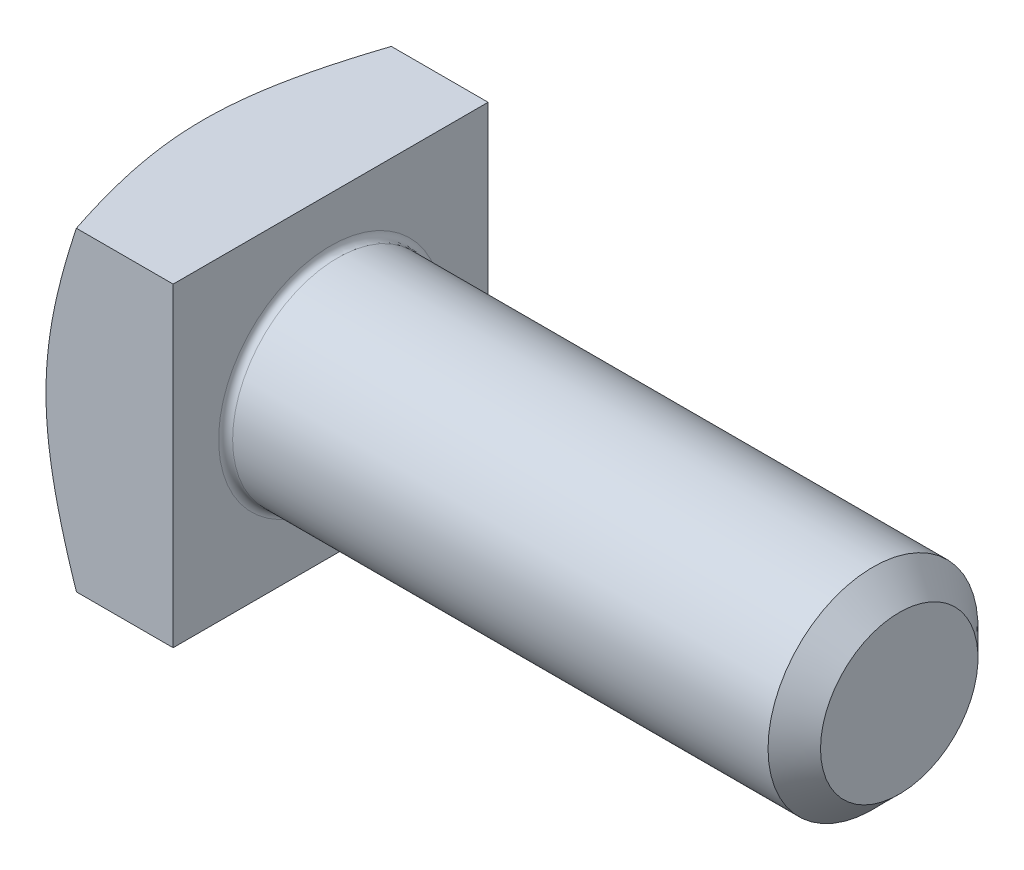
SolidWorks part; units mm, degrees
ref_plane "Front Plane" through (0, 0, 0) normal (0, 0, 1) x (1, 0, 0)
ref_plane "Top Plane" through (0, 0, 0) normal (0, 1, 0) x (1, 0, 0)
ref_plane "Right Plane" through (0, 0, 0) normal (1, 0, 0) x (0, 0, -1)
sketch "BaseHeadSke" plane through (0, 0, 0) normal (1, 0, 0) x (0, 0, -1)
  line L0 (18, 18) -> (-18, -18) construction
  line L2 (18, 18) -> (-18, 18)
  line L3 (-18, 18) -> (-18, -18)
  line L5 (-18, -18) -> (18, -18)
  line L6 (18, -18) -> (18, 18)
  dimension "Width_flats" = 36
extrude "BaseHead" add sketch "BaseHeadSke" along normal blind 15
sketch "BodySke" plane through (0, 0, 0) normal (0, 0, 1) x (1, 0, 0)
  line L0 (0, 0) -> (80, 0)
  line L1 (80, 0) -> (80, 12)
  line L2 (51.3878, 10.352) -> (123.0174, 10.352) construction
  line L3 (80, 12) -> (0, 12)
  line L4 (0, 12) -> (0, 0)
  line L5 (15, 18) -> (15, -18) construction
  line L6 (0, 0) -> (159.3976, 0) construction
  line L7 (26, -84.3176) -> (26, 77.7215) construction
  line L8 (77, -21.5941) -> (77, 39.2994) construction
  dimension "Length" = 65
  dimension "Diameter" = 24
  dimension "Minor_dia" = 20.704
  dimension "Thread_length" = 54
  dimension "Advance" = 3
revolve "BaseBody" add sketch "BodySke" angle 360 about L6
sketch "ChamferEndSke" plane through (0, 0, 0) normal (0, 1, 0) x (1, 0, 0)
  line L0 (77, -12) -> (80, -9)
  line L1 (80, -9) -> (80, -12)
  line L2 (80, -12) -> (77, -12)
  line L4 (80, -12) -> (80, 12) construction
  line L5 (15, -12) -> (80, -12) construction
  line L6 (0, 0) -> (120.8692, 0) construction
  dimension "Ang" = 45
  dimension "Chamfer_width" = 3
revolve "ChamferEnd" cut sketch "ChamferEndSke" angle 360 about L6
sketch "CutEndSke" plane through (80, 0, 0) normal (1, 0, 0) x (0, 0, -1)
  circle A0 centre (0, 0) radius 12 construction
  circle A1 centre (0, 0) radius 12
extrude "CutEnd" [suppressed] cut sketch "CutEndSke" against normal blind 3
dome "RoundEnd" [suppressed] faces to dome 1 distance 3 parameters "D1"=3
sketch "HeadChamferSke" plane through (0, 0, 0) normal (0, 0, 1) x (1, 0, 0)
  line L0 (15, 49.1676) -> (0, 49.1676)
  line L1 (0, 49.1676) -> (0, 17)
  line L2 (0, 17) -> (15, 49.1676)
  line L3 (0, 0) -> (120.9185, 0) construction
  dimension "D1" = 25
  dimension "Head_chamfer" = 34
revolve "HeadChamfer" cut sketch "HeadChamferSke" angle 360 about L3
fillet "Fillet" radius 0.8 1 edges at (15, 0, -12)
sketch "ThdSchSke" plane through (0, 0, 0) normal (0, 0, 1) x (1, 0, 0)
  line L0 (74.5485, 13.9029) -> (74.5485, 12)
  line L1 (74.5485, 12) -> (75.5, 10.352)
  line L2 (75.5, 10.352) -> (76.4515, 12)
  line L3 (76.4515, 12) -> (76.4515, 13.9029)
  line L4 (76.4515, 13.9029) -> (74.5485, 13.9029)
  line L6 (0, 0) -> (141.9934, 0) construction
  line L8 (80, -61.7617) -> (80, 46.755) construction
  line L9 (15, -18) -> (15, 18) construction
  dimension "D2" = 20.704
  dimension "D3" = 24
  dimension "Advance" = 4.5
  dimension "Length" = 65
revolve "ThreadSchematic" [suppressed] cut sketch "ThdSchSke" angle 360 about L6
pattern_linear "ThdSchPat" [suppressed] count 18 spacing 3 along (1, 0, 0)
equation "\"Thread_minor@ThreadCosmetic\" = \"Minor_dia@BodySke\""
equation "\"Thread_length@ThreadCosmetic\" = \"Thread_length@BodySke\""
equation "\"D1@CutEnd\" = \"Chamfer_width@ChamferEndSke\""
equation "\"D1@RoundEnd\" = \"Chamfer_width@ChamferEndSke\""
equation "\"D2@ThdSchSke\" = \"Minor_dia@BodySke\""
equation "\"D3@ThdSchSke\" = \"Diameter@BodySke\""
equation "\"Length@ThdSchSke\" = \"Length@BodySke\""
equation "\"Advance@ThdSchSke\" = \"Advance@BodySke\"*1.5"
equation "\"D3@ThdSchPat\" = \"Advance@BodySke\""
equation "\"D1@ThdSchPat\" =  int( \"Thread_length@BodySke\"/\"Advance@BodySke\" )"
